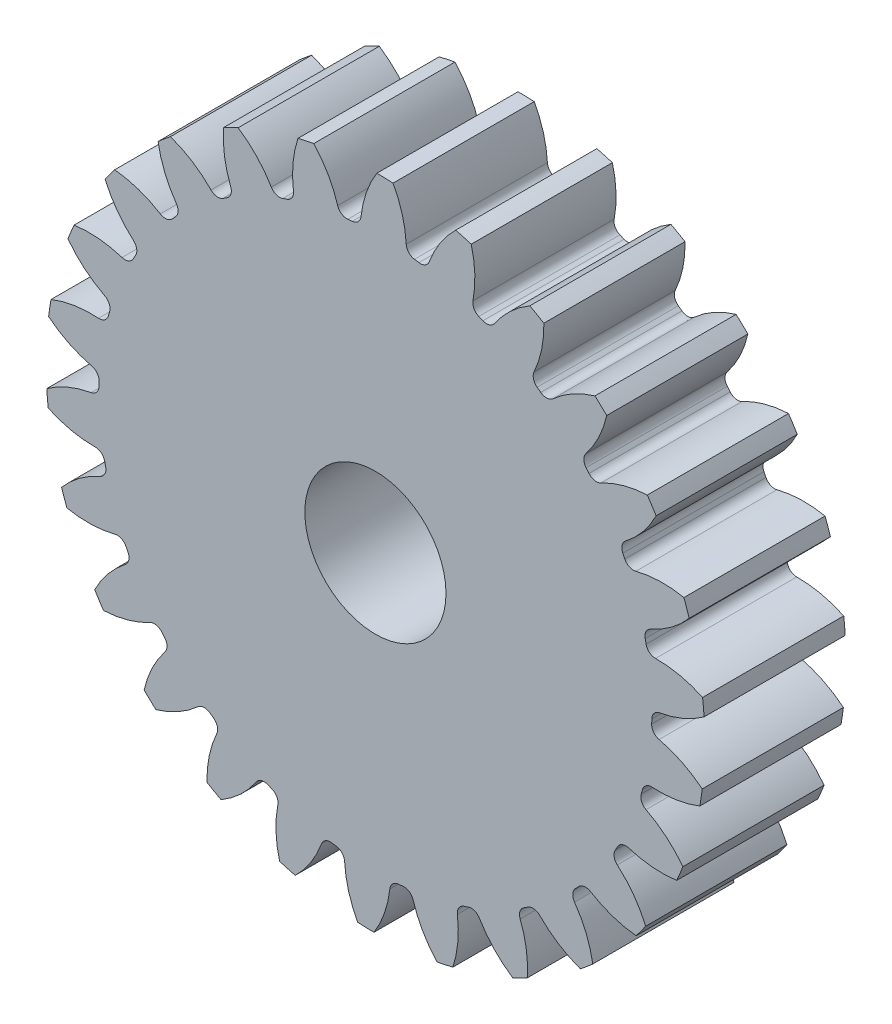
SolidWorks part; units mm, degrees
ref_plane "Front" through (0, 0, 0) normal (0, 0, 1) x (1, 0, 0)
ref_plane "Top" through (0, 0, 0) normal (0, 1, 0) x (1, 0, 0)
ref_plane "Right" through (0, 0, 0) normal (1, 0, 0) x (0, 0, -1)
sketch "Sketch3" plane through (0, 0, 0) normal (0, 0, 1) x (1, 0, 0)
  circle A0 centre (0, 0) radius 237.0667
  dimension "od" = 474.1333
extrude "gearBody" add sketch "Sketch3" along normal blind 101.6
sketch "Sketch2" plane through (0, 0, 0) normal (0, 0, 1) x (1, 0, 0)
  line L0 (0, 0) -> (191.1116, 79.161) construction
  line L1 (235.7257, -30.013) -> (0, 0) construction
  line L2 (0, 0) -> (36.3143, 0) construction
  line L3 (220.0255, 6.89) -> (219.2591, -19.5996) construction
  line L5 (219.6423, -6.3548) -> (0, 0) construction
  line L7 (0, 0) -> (206.8577, 0) construction
  arc A0 (206.837, 2.9257) -> (206.3218, -14.8794) centre (0, 0) ccw construction
  arc A1 (236.5298, 15.9448) -> (235.2123, -29.5934) centre (0, 0) ccw construction
  arc A2 (220.0255, 6.89) -> (219.2591, -19.5996) centre (0, 0) ccw construction
  arc A3 (198.8303, -7.3656) -> (198.9235, -4.1424) centre (0, 0) ccw
  arc A4 (235.7257, -30.013) -> (204.1312, -14.3276) centre (186.2151, -90.078) ccw
  arc A5 (235.7257, -30.013) -> (237.0667, 16.3339) centre (0, 0) ccw
  arc A6 (237.0667, 16.3339) -> (204.6181, 2.5014) centre (191.1116, 79.161) cw
  arc A7 (198.9235, -4.1424) -> (204.6181, 2.5014) centre (205.8139, -4.2859) cw
  arc A8 (204.1312, -14.3276) -> (198.8303, -7.3656) centre (205.7174, -7.6207) cw
  point P6 (237.0667, 16.3339)
  point P22 (235.7257, -30.013)
  dimension "baseDia" = 413.7153
  dimension "od" = 474.1333
  dimension "pd" = 440.2667
  dimension "rd" = 397.9333
  dimension "rFillet" = 6.8919
  dimension "pointX" = 237.0667
  dimension "pointY" = 16.3339
  dimension "CTT" = 26.4896
  dimension "flankCenterAngle" = 22.5
extrude "toothCut" cut sketch "Sketch2" along normal through all
pattern_circular "CirPattern1" count 26 over 360 about axis through (0, 0, 0) along (0, 0, 1) of "toothCut"
sketch "hub1Dia" plane through (0, 0, 0) normal (0, 0, -1) x (-1, 0, 0)
  circle A0 centre (0, 0) radius 12.7
  dimension "hub1Dia" = 25.4
sketch "hub2Dia" plane through (0, 0, 101.6) normal (0, 0, 1) x (1, 0, 0)
  circle A0 centre (0, 0) radius 12.7
  dimension "hub2dia" = 25.4
sketch "boreDia" plane through (0, 0, 0) normal (0, 0, 1) x (1, 0, 0)
  circle A0 centre (0, 0) radius 50.8
  dimension "boreDia" = 101.6
extrude "bore" cut sketch "boreDia" against normal mid plane 25400
